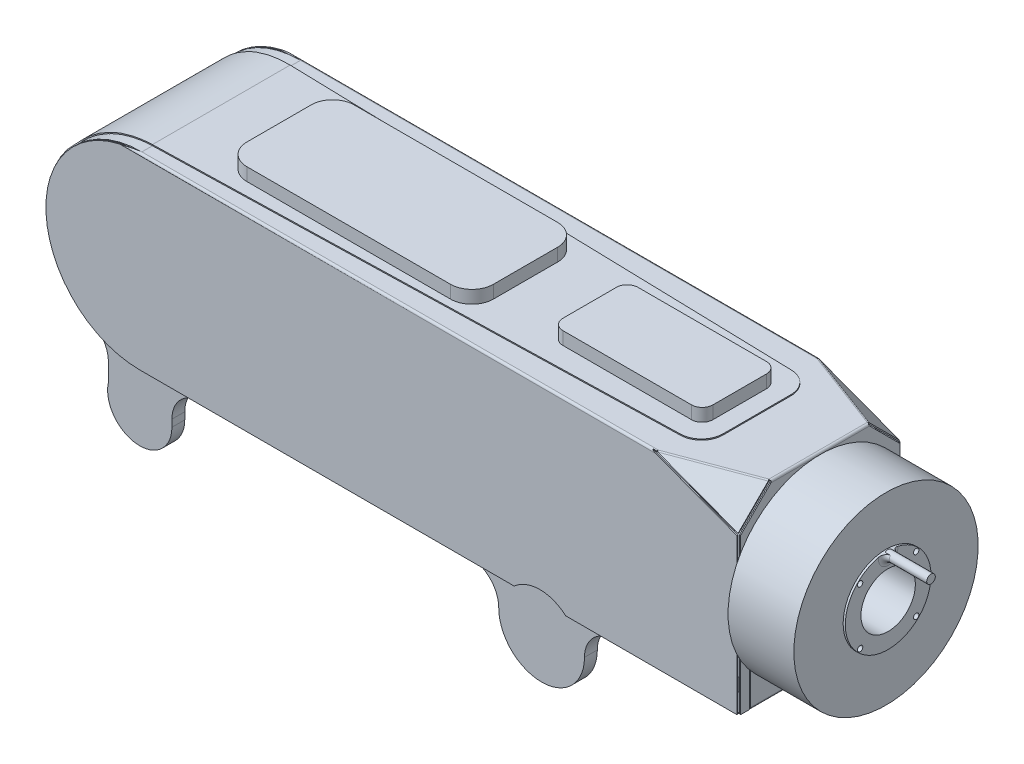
SolidWorks part; units mm, degrees
ref_plane "Ebene vorne" through (0, 0, 0) normal (0, 0, 1) x (1, 0, 0)
ref_plane "Ebene oben" through (0, 0, 0) normal (0, 1, 0) x (1, 0, 0)
ref_plane "Ebene rechts" through (0, 0, 0) normal (1, 0, 0) x (0, 0, -1)
imported_body "Defeature ausgeführt20"
imported_body "Defeature ausgeführt21"
imported_body "Defeature ausgeführt22"
imported_body "Defeature ausgeführt23"
imported_body "Defeature ausgeführt30"
imported_body "Defeature ausgeführt24"
imported_body "Defeature ausgeführt25" [suppressed]
imported_body "Defeature ausgeführt26"
imported_body "Defeature ausgeführt27"
imported_body "Defeature ausgeführt28"
imported_body "Defeature ausgeführt29"
other "Fläche löschen1"
other "Fläche löschen2"
delete or keep bodies "Körper-Löschen/beibehalten 1" [suppressed] type keep bodies bodies 130
delete or keep bodies "Körper-Löschen/beibehalten 2" [suppressed] type delete bodies bodies 130
